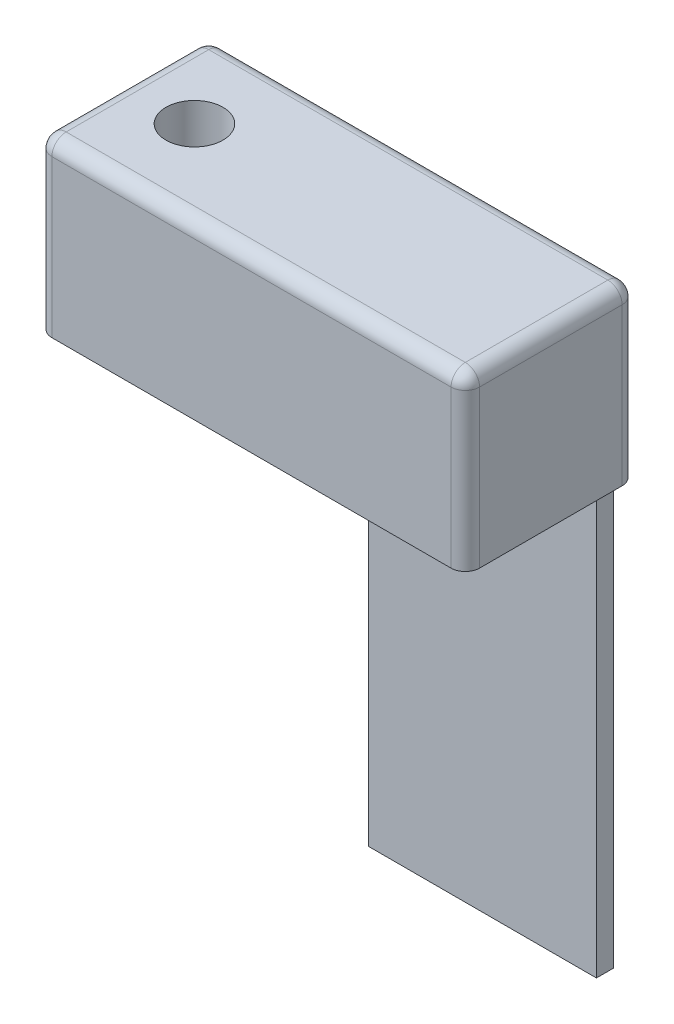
SolidWorks part; units mm, degrees
ref_plane "Front Plane" through (0, 0, 0) normal (0, 0, 1) x (1, 0, 0)
ref_plane "Top Plane" through (0, 0, 0) normal (0, 1, 0) x (1, 0, 0)
ref_plane "Right Plane" through (0, 0, 0) normal (1, 0, 0) x (0, 0, -1)
sketch "Sketch1" plane through (0, 0, 0) normal (0, 1, 0) x (1, 0, 0)
  line L1 (-190.5, -76.2) -> (190.5, -76.2)
  line L2 (-190.5, -76.2) -> (-190.5, 76.2)
  line L3 (-190.5, 76.2) -> (190.5, 76.2)
  line L4 (190.5, -76.2) -> (190.5, 76.2)
  line L5 (-190.5, -76.2) -> (190.5, 76.2) construction
  line L6 (-190.5, 76.2) -> (190.5, -76.2) construction
  point P0 (0, 0)
  dimension "D1" = 381
  dimension "D2" = 152.4
extrude "Boss-Extrude1" add sketch "Sketch1" along normal blind 152.4
sketch "Sketch2" plane through (0, 0, -76.2) normal (0, 0, -1) x (-1, 0, 0)
  circle A0 centre (0, 76.2) radius 50.8
extrude "Cut-Extrude1" cut sketch "Sketch2" against normal blind 76.2
sketch "Sketch3" plane through (0, 152.4, 0) normal (0, 1, 0) x (1, 0, 0)
  line L0 (190.5, 76.2) -> (-190.5, 76.2) construction
  line L1 (-190.5, 76.2) -> (-190.5, -76.2) construction
  circle A0 centre (-127, 0) radius 25.4
  dimension "D1" = 76.2
  dimension "D2" = 50.8
  dimension "D3" = 63.5
extrude "Cut-Extrude2" cut sketch "Sketch3" against normal blind 203.2
sketch "Sketch4" plane through (0, 0, 0) normal (0, -1, 0) x (1, 0, 0)
  line L1 (-25.4, -53.34) -> (177.8, -53.34)
  line L2 (-25.4, -53.34) -> (-25.4, -68.58)
  line L3 (-25.4, -68.58) -> (177.8, -68.58)
  line L4 (177.8, -53.34) -> (177.8, -68.58)
  line L5 (-25.4, -53.34) -> (177.8, -68.58) construction
  line L6 (-25.4, -68.58) -> (177.8, -53.34) construction
  line L7 (190.5, -76.2) -> (-190.5, -76.2) construction
  line L8 (190.5, 76.2) -> (190.5, -76.2) construction
  point P0 (223.8212, 14.0089)
  dimension "D1" = 15.24
  dimension "D2" = 7.62
  dimension "D3" = 12.7
  dimension "D4" = 203.2
extrude "Boss-Extrude3" add sketch "Sketch4" along normal blind 381
fillet "Fillet1" radius 12.7 8 edges at (-190.5, 76.2, 76.2) (0, 152.4, 76.2) (-190.5, 152.4, 0) (-190.5, 76.2, -76.2) (0, 152.4, -76.2) (190.5, 76.2, -76.2) (190.5, 152.4, 0) (190.5, 76.2, 76.2)
